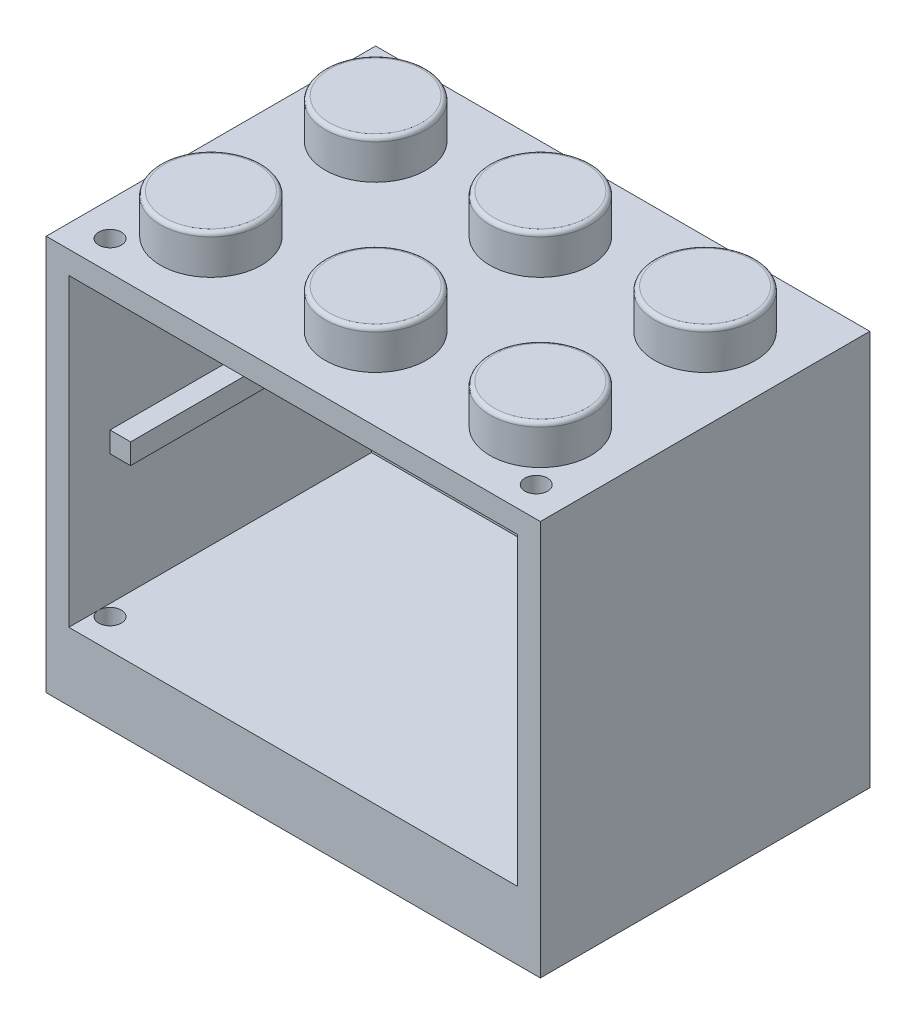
SolidWorks part; units mm, degrees
ref_plane "Vorne" through (0, 0, 0) normal (0, 0, 1) x (1, 0, 0)
ref_plane "Oben" through (0, 0, 0) normal (0, 1, 0) x (1, 0, 0)
ref_plane "Rechts" through (0, 0, 0) normal (1, 0, 0) x (0, 0, -1)
sketch "Skizze1" plane through (0, 0, 0) normal (0, 0, 1) x (1, 0, 0)
  line L1 (0, 0) -> (24, 0)
  line L2 (0, 0) -> (0, 19.2)
  line L3 (0, 19.2) -> (24, 19.2)
  line L4 (24, 0) -> (24, 19.2)
  dimension "D1" = 24
  dimension "D2" = 19.2
extrude "Linear austragen1" add sketch "Skizze1" along normal blind 16
sketch "Skizze3" plane through (0, 0, 0) normal (0, -1, 0) x (1, 0, 0)
  line L0 (0, 16) -> (0, 0) construction
  line L1 (1.6, 14.4) -> (22.4, 14.4)
  line L2 (1.6, 14.4) -> (1.6, 1.6)
  line L3 (1.6, 1.6) -> (22.4, 1.6)
  line L4 (22.4, 14.4) -> (22.4, 1.6)
  line L5 (24, 16) -> (24, 0) construction
  line L6 (0, 16) -> (24, 16) construction
  line L7 (0, 0) -> (24, 0) construction
  dimension "D1" = 1.6
  dimension "D2" = 1.6
  dimension "D3" = 1.6
  dimension "D4" = 1.6
extrude "Schnitt-Linear austragen1" cut sketch "Skizze3" against normal blind 2.1
sketch "Skizze5" plane through (0, 2.1, 0) normal (0, -1, 0) x (1, 0, 0)
  line L0 (0, 16) -> (24, 16) construction
  line L1 (10.56, 0) -> (-10.56, 0) construction
  line L3 (24, 16) -> (24, 0) construction
  line L4 (0, 16) -> (0, 0) construction
  circle A0 centre (8, 8) radius 3.25
  circle A1 centre (8, 8) radius 2.45
  circle A2 centre (16, 8) radius 3.25
  circle A3 centre (16, 8) radius 2.45
  dimension "D1" = 8
  dimension "D2" = 8
  dimension "D3" = 8
  dimension "D4" = 8
extrude "Linear austragen2" add sketch "Skizze5" along normal blind 2
sketch "Skizze6" plane through (0, 19.2, 0) normal (0, 1, 0) x (-1, 0, 0)
  line L0 (0, 16) -> (0, 0) construction
  line L1 (-24, 16) -> (0, 16) construction
  line L2 (10.56, 0) -> (-10.56, 0) construction
  line L3 (-4, 4) -> (-22.755, 4) construction
  line L4 (-4, 12) -> (-22.2952, 12) construction
  line L5 (-24, 16) -> (-24, 0) construction
  circle A0 centre (-4, 4) radius 2.45
  circle A1 centre (-12, 4) radius 2.45
  circle A2 centre (-20, 4) radius 2.45
  circle A3 centre (-4, 12) radius 2.45
  circle A4 centre (-12, 12) radius 2.45
  circle A5 centre (-20, 12) radius 2.45
  dimension "D1" = 4.9
  dimension "D2" = 4.9
  dimension "D3" = 4.9
  dimension "D4" = 4.9
  dimension "D5" = 4.9
  dimension "D6" = 4.9
  dimension "D7" = 4
  dimension "D8" = 4
  dimension "D9" = 4
  dimension "D10" = 4
  dimension "D11" = 4
  dimension "D12" = 4
  dimension "D13" = 8
  dimension "D14" = 8
extrude "Linear austragen3" add sketch "Skizze6" along normal blind 1.9
fillet "Verrundung1" radius 0.2 6 edges at (4, 21.1, 6.45) (12, 21.1, 6.45) (20, 21.1, 6.45) (4, 21.1, 14.45) (12, 21.1, 14.45) (20, 21.1, 14.45)
sketch "Skizze7" plane through (0, 0, 16) normal (0, 0, 1) x (1, 0, 0)
  line L0 (0, 0) -> (24, 0) construction
  line L1 (1.1, 18.1) -> (22.9, 18.1)
  line L2 (1.1, 18.1) -> (1.1, 3.3)
  line L3 (1.1, 3.3) -> (22.9, 3.3)
  line L4 (22.9, 18.1) -> (22.9, 3.3)
  line L5 (24, 19.2) -> (0, 19.2) construction
  line L6 (0, 19.2) -> (0, 0) construction
  line L7 (24, 0) -> (24, 19.2) construction
  dimension "D1" = 3.3
  dimension "D2" = 1.1
  dimension "D3" = 1.1
  dimension "D4" = 1.1
extrude "Schnitt-Linear austragen2" cut sketch "Skizze7" against normal blind 14.7
sketch "Skizze8" plane through (0, 0, 0) normal (0, -1, 0) x (1, 0, 0)
  line L0 (22.9, 1.3) -> (22.9, 16) construction
  line L1 (1.1, 1.3) -> (1.1, 16) construction
  line L2 (22.4, 14.4) -> (1.6, 14.4) construction
  circle A0 centre (1.65, 14.55) radius 0.55
  circle A1 centre (22.35, 14.55) radius 0.55
  dimension "D1" = 0.15
  dimension "D2" = 0.55
  dimension "D3" = 0.15
  dimension "D5" = 1.1
  dimension "D6" = 1.1
  dimension "D4" = 0.55
extrude "Schnitt-Linear austragen3" cut sketch "Skizze8" against normal through all
sketch "Skizze9" plane through (0, 0, 1.3) normal (0, 0, 1) x (1, 0, 0)
  line L0 (1.1, 18.1) -> (1.1, 3.3) construction
  line L1 (1.1, 18.1) -> (1.6, 18.1)
  line L2 (1.1, 18.1) -> (1.1, 17.1)
  line L3 (1.1, 17.1) -> (1.6, 17.1)
  line L4 (1.6, 18.1) -> (1.6, 17.1)
  line L5 (22.9, 18.1) -> (22.4, 18.1)
  line L6 (22.9, 18.1) -> (22.9, 17.1)
  line L7 (22.9, 17.1) -> (22.4, 17.1)
  line L8 (22.4, 18.1) -> (22.4, 17.1)
  line L9 (1.1, 10.6) -> (2.1, 10.6)
  line L10 (1.1, 10.6) -> (1.1, 9.6)
  line L11 (1.1, 9.6) -> (2.1, 9.6)
  line L12 (2.1, 10.6) -> (2.1, 9.6)
  line L13 (22.9, 3.3) -> (22.9, 18.1) construction
  line L14 (22.9, 10.6) -> (21.9, 10.6)
  line L15 (22.9, 10.6) -> (22.9, 9.6)
  line L16 (22.9, 9.6) -> (21.9, 9.6)
  line L17 (21.9, 10.6) -> (21.9, 9.6)
  dimension "D1" = 1
  dimension "D2" = 1
  dimension "D3" = 1
  dimension "D4" = 1
  dimension "D5" = 6.5
  dimension "D6" = 6.5
  dimension "D7" = 1
  dimension "D8" = 1
  dimension "D9" = 0.5
  dimension "D10" = 0.5
extrude "Linear austragen5" add sketch "Skizze9" along normal blind 12.7
fillet "Verrundung3" radius 0.2 1 edges at (21.9, 10.1, 14)
fillet "Verrundung4" radius 0.1 1 edges at (22.4, 17.6, 14)
fillet "Verrundung5" radius 0.1 1 edges at (1.6, 17.6, 14)
